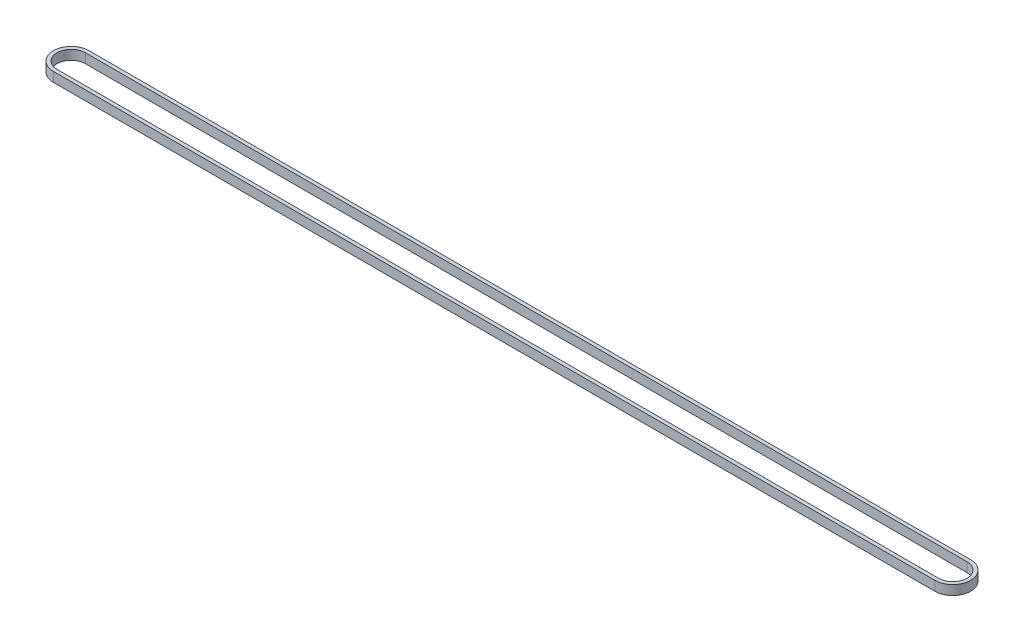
SolidWorks part; units mm, degrees
ref_plane "前视基准面" through (0, 0, 0) normal (0, 0, 1) x (1, 0, 0)
ref_plane "上视基准面" through (0, 0, 0) normal (0, 1, 0) x (1, 0, 0)
ref_plane "右视基准面" through (0, 0, 0) normal (1, 0, 0) x (0, 0, -1)
other "Configuration Table"
sketch "草图2" plane through (0, 0, 0) normal (0, 1, 0) x (1, 0, 0)
  line L0 (0, 7.5) -> (370, 7.5)
  line L1 (0, 6) -> (370, 6)
  line L2 (0, -6) -> (370, -6)
  line L3 (0, -7.5) -> (370, -7.5)
  arc A0 (0, 6) -> (0, -6) centre (0, 0) ccw
  arc A1 (370, -6) -> (370, 6) centre (370, 0) ccw
  arc A2 (370, -7.5) -> (370, 7.5) centre (370, 0) ccw
  arc A3 (0, 7.5) -> (0, -7.5) centre (0, 0) ccw
  dimension "D1" = 1.5
  dimension "D2" = 370
extrude "凸台-拉伸2" add sketch "草图2" along normal blind 4
